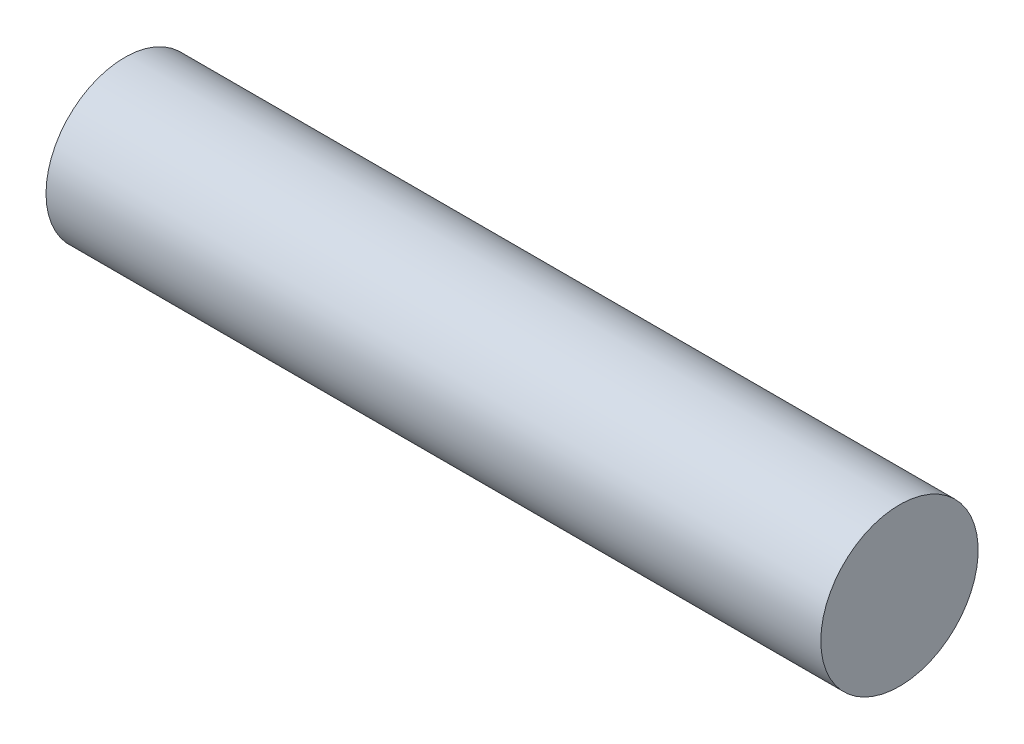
SolidWorks part; units mm, degrees
ref_plane "Ebene vorne" through (0, 0, 0) normal (0, 0, 1) x (1, 0, 0)
ref_plane "Ebene oben" through (0, 0, 0) normal (0, 1, 0) x (1, 0, 0)
ref_plane "Ebene rechts" through (0, 0, 0) normal (1, 0, 0) x (0, 0, -1)
sketch "Skizze1" plane through (0, 0, 0) normal (0, 0, 1) x (1, 0, 0)
  line L0 (-46.7567, 0) -> (50.6185, 0) construction
  line L2 (-35.753, 0) -> (-35.753, -7.3922)
  line L3 (-35.753, -7.3922) -> (37.0523, -7.3922)
  line L4 (37.0523, 0) -> (37.0523, -7.3922)
  line L5 (55, 0) -> (-55, 0) construction
  line L6 (37.0523, 0) -> (-35.753, 0)
revolve "Rotation1" add sketch "Skizze1" angle 360 about L0
